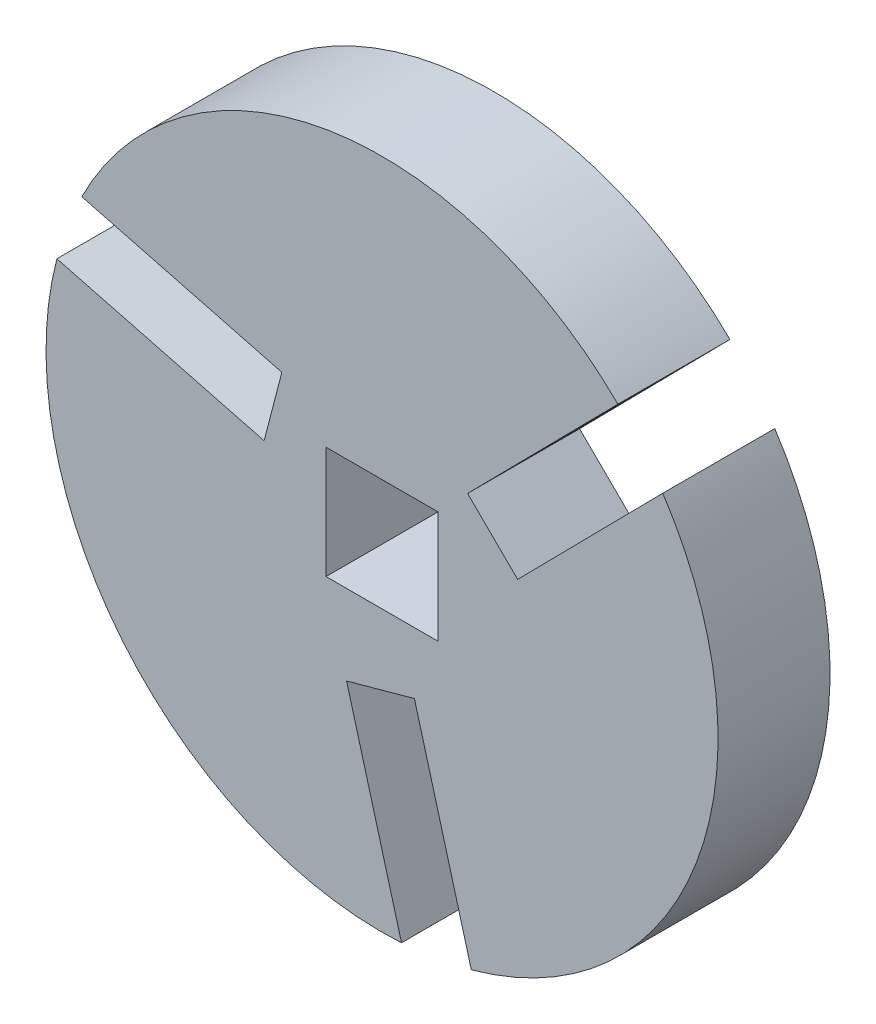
SolidWorks part; units mm, degrees
ref_plane "Front Plane" through (0, 0, 0) normal (0, 0, 1) x (1, 0, 0)
ref_plane "Top Plane" through (0, 0, 0) normal (0, 1, 0) x (1, 0, 0)
ref_plane "Right Plane" through (0, 0, 0) normal (1, 0, 0) x (0, 0, -1)
sketch "Sketch1" plane through (0, 0, 0) normal (0, 0, 1) x (1, 0, 0)
  line L0 (0, 0) -> (-6.7481, 24.4872) construction
  line L1 (0, 0) -> (17.8325, 18.0876) construction
  line L2 (0, 0) -> (24.5806, -6.3996) construction
  line L3 (0, 0) -> (6.7481, -24.4872) construction
  line L4 (0, 0) -> (-17.8325, -18.0876) construction
  line L5 (0, 0) -> (-24.5806, 6.3996) construction
  line L6 (-5.0611, 18.3654) -> (-5.9035, 21.4224) construction
  line L7 (13.3744, 13.5657) -> (15.6006, 15.8238) construction
  line L8 (18.4354, -4.7997) -> (21.5041, -5.5986) construction
  line L9 (5.0611, -18.3654) -> (5.9035, -21.4224) construction
  line L10 (-13.3744, -13.5657) -> (-15.6006, -15.8238) construction
  line L11 (-18.4354, 4.7997) -> (-21.5041, 5.5986) construction
  line L12 (-19.635, 9.2333) -> (7.6902, 2.1192) construction
  line L13 (-1.8212, 21.6211) -> (5.6804, -5.6003) construction
  line L14 (17.8138, 12.3877) -> (-2.0098, -7.7195) construction
  line L15 (19.635, -9.2333) -> (-7.6902, -2.1192) construction
  line L16 (1.8212, -21.6211) -> (-5.6804, 5.6003) construction
  line L17 (-17.8138, -12.3877) -> (2.0098, 7.7195) construction
  line L18 (-5.6804, 5.6003) -> (-7.6902, -2.1192) construction
  line L19 (-7.6902, -2.1192) -> (-2.0098, -7.7195) construction
  line L20 (-2.0098, -7.7195) -> (5.6804, -5.6003) construction
  line L21 (5.6804, -5.6003) -> (7.6902, 2.1192) construction
  line L22 (7.6902, 2.1192) -> (2.0098, 7.7195) construction
  line L23 (2.0098, 7.7195) -> (-5.6804, 5.6003) construction
  line L24 (-10.6751, 6.9006) -> (-5.6804, 5.6003)
  line L25 (-12.2903, 3.1998) -> (-18.4354, 4.7997)
  line L26 (-17.022, 8.553) -> (-10.6751, 6.9006)
  line L28 (-0.6417, -12.6838) -> (-2.0098, -7.7195)
  line L30 (1.1038, -19.018) -> (-0.6417, -12.6838)
  line L31 (-2.0098, -7.7195) -> (1.8353, -6.6599)
  line L32 (3.3741, -12.2436) -> (5.0611, -18.3654)
  line L36 (13.3744, 13.5657) -> (8.9162, 9.0438)
  line L38 (11.3053, 5.7861) -> (15.9181, 10.4649)
  line L42 (-5.6804, 5.6003) -> (-6.6853, 1.7405)
  line L43 (-3.175, -3.175) -> (3.175, -3.175)
  line L44 (-3.175, -3.175) -> (-3.175, 3.175)
  line L45 (-3.175, 3.175) -> (3.175, 3.175)
  line L46 (3.175, -3.175) -> (3.175, 3.175)
  line L47 (-3.175, -3.175) -> (3.175, 3.175) construction
  line L48 (-3.175, 3.175) -> (3.175, -3.175) construction
  line L49 (-6.6853, 1.7405) -> (-12.2903, 3.1998)
  line L53 (1.8353, -6.6599) -> (3.3741, -12.2436)
  line L57 (11.3053, 5.7861) -> (7.6902, 2.1192)
  line L58 (7.6902, 2.1192) -> (4.85, 4.9194)
  line L59 (4.85, 4.9194) -> (8.9162, 9.0438)
  circle A0 centre (0, 0) radius 25.4 construction
  arc A1 (-18.4354, 4.7997) -> (-15.9181, -10.4649) centre (0, 0) ccw construction
  circle A2 centre (0, 0) radius 22.221 construction
  circle A3 centre (0, 0) radius 12.7 construction
  arc A4 (13.3744, 13.5657) -> (-17.022, 8.553) centre (0, 0) ccw
  arc A5 (-5.0611, 18.3654) -> (-17.022, 8.553) centre (0, 0) ccw construction
  arc A6 (-18.4354, 4.7997) -> (1.1038, -19.018) centre (0, 0) ccw
  arc A7 (13.3744, 13.5657) -> (-1.1038, 19.018) centre (0, 0) ccw construction
  arc A9 (18.4354, -4.7997) -> (15.9181, 10.4649) centre (0, 0) ccw construction
  arc A11 (5.0611, -18.3654) -> (17.022, -8.553) centre (0, 0) ccw construction
  arc A13 (-13.3744, -13.5657) -> (1.1038, -19.018) centre (0, 0) ccw construction
  arc A15 (5.0611, -18.3654) -> (15.9181, 10.4649) centre (0, 0) ccw
  spline S0 degree 2 poles (-5.9035, 21.4224) (6.1634, 22.9446) (13.3744, 13.5657) knots 0 0 0 1 1 1 construction
  spline S1 degree 2 poles (15.6006, 15.8238) (22.9523, 6.1346) (18.4354, -4.7997) knots 0 0 0 1 1 1 construction
  spline S2 degree 2 poles (21.5041, -5.5986) (16.7889, -16.81) (5.0611, -18.3654) knots 0 0 0 1 1 1 construction
  spline S3 degree 2 poles (5.9035, -21.4224) (-6.1634, -22.9446) (-13.3744, -13.5657) knots 0 0 0 1 1 1 construction
  spline S4 degree 2 poles (-15.6006, -15.8238) (-22.9523, -6.1346) (-18.4354, 4.7997) knots 0 0 0 1 1 1 construction
  spline S5 degree 2 poles (-21.5041, 5.5986) (-16.7889, 16.81) (-5.0611, 18.3654) knots 0 0 0 1 1 1 construction
  spline S6 degree 2 poles (-21.5041, 5.5986) (-20.7154, 7.4917) (-19.635, 9.2333) knots 0 0 0 1 1 1 construction
  dimension "D1" = 6
  dimension "D3" = 6.35
  dimension "D4" = 6.35
extrude "Boss-Extrude1" add sketch "Sketch1" along normal blind 6.35
